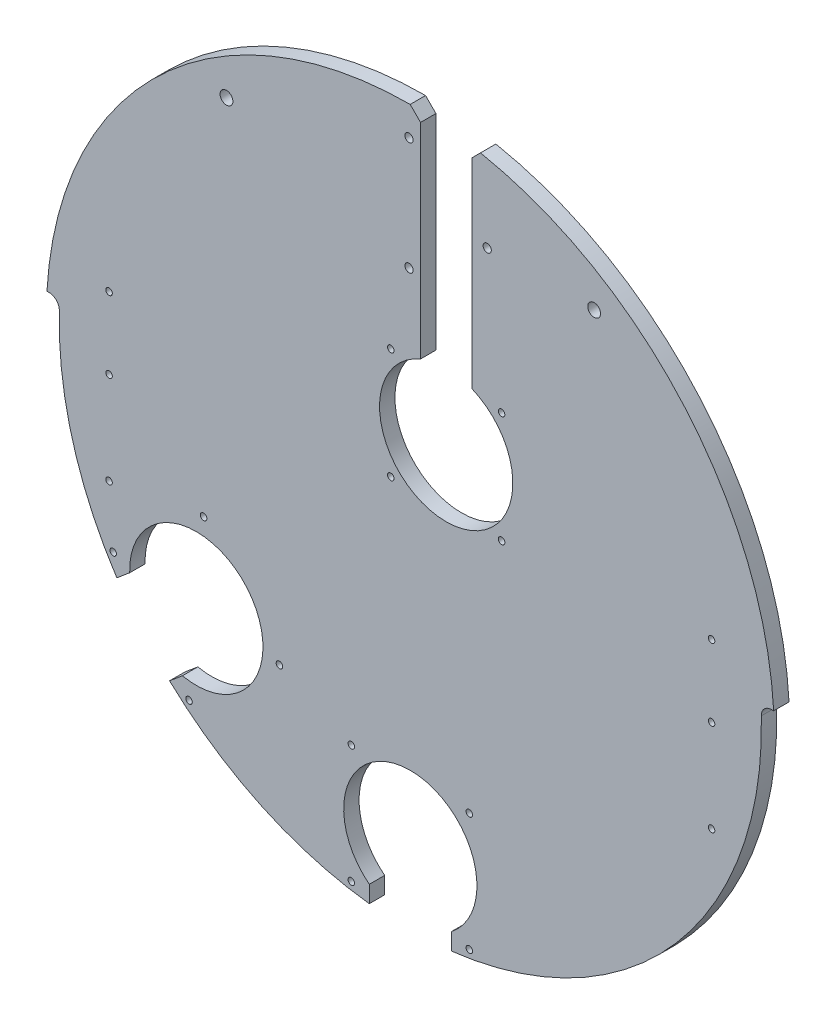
SolidWorks part; units mm, degrees
ref_plane "Front Plane" through (0, 0, 0) normal (0, 0, 1) x (1, 0, 0)
ref_plane "Top Plane" through (0, 0, 0) normal (0, 1, 0) x (1, 0, 0)
ref_plane "Right Plane" through (0, 0, 0) normal (1, 0, 0) x (0, 0, -1)
sketch "Sketch1" plane through (0, 0, 0) normal (0, 0, 1) x (1, 0, 0)
  line L5 (-254, 6.35) -> (254, 6.35) construction
  line L6 (0, 0) -> (0, 6.35) construction
  circle A0 centre (0, 0) radius 217.4875
  dimension "D1" = 434.975
extrude "Boss-Extrude1" add sketch "Sketch1" along normal mid plane 9.525
hole_wizard "#10-32 Tapped Hole1" positions "Sketch3" profile "Sketch2" tap size "#10-32" standard "ANSI Inch"
sketch "Sketch3" plane through (0, 0, 4.7625) normal (0, 0, 1) x (1, 0, 0)
  line L0 (0, 0) -> (0, -270.3197) construction
  circle A0 centre (-186.5948, 31.75) radius 2.8067 construction
  circle A1 centre (-186.5948, -69.85) radius 2.8067 construction
  circle A2 centre (-186.5948, -12.7) radius 2.8067 construction
  point P0 (-186.5948, -69.85)
  point P9 (-186.5948, 31.75)
  point P13 (186.5948, -69.85)
  point P14 (186.5948, 31.75)
  point P21 (-186.5948, -12.7)
  point P27 (186.5948, -12.7)
sketch "Sketch2" plane through (-186.5948, -69.85, 4.7625) normal (1, 0, 0) x (0, -1, 0)
  line L0 (0, 0) -> (0, 10.7383)
  line L1 (0, 10.7383) -> (2.0193, 9.525)
  line L2 (2.0193, 9.525) -> (2.0193, 0)
  line L5 (2.0193, 0) -> (0, 0)
  line L10 (0, 10.7383) -> (-2.0193, 9.525) construction
  line L11 (0, -6.35) -> (0, 107.95) construction
  dimension "Tap Drill Dia." = 4.0386
  dimension "Tap Drill Depth" = 9.525
  dimension "Drill Angle" = 118
sketch "Sketch4" plane through (0, 0, 4.7625) normal (0, 0, 1) x (1, 0, 0)
  line L0 (-132.5544, -111.2264) -> (132.5544, -111.2264) construction
  line L1 (0, 0) -> (0, -111.2264) construction
  line L2 (0, 0) -> (-132.5544, -111.2264) construction
  line L3 (-63.5, 98.425) -> (63.5, 98.425) construction
  line L4 (-63.5, 98.425) -> (-63.5, 15.875) construction
  line L5 (-63.5, 15.875) -> (63.5, 15.875) construction
  line L6 (63.5, 98.425) -> (63.5, 15.875) construction
  line L7 (-63.5, 98.425) -> (63.5, 15.875) construction
  line L8 (-63.5, 15.875) -> (63.5, 98.425) construction
  line L9 (0, 0) -> (0, -173.0375) construction
  line L10 (0, 0) -> (-44.858, 37.3498) construction
  line L11 (22.225, 53.975) -> (-22.225, 53.975) construction
  line L12 (22.225, 53.975) -> (0, 0) construction
  line L13 (-132.5544, -111.2264) -> (0, -173.0375) construction
  line L14 (0, 53.975) -> (0, 0) construction
  circle A0 centre (-132.5544, -111.2264) radius 41.275
  circle A1 centre (132.5544, -111.2264) radius 41.275 construction
  circle A2 centre (0, -173.0375) radius 41.275
  circle A3 centre (0, 57.15) radius 41.275 construction
  arc A4 (4.1485, 85.725) -> (4.1485, 22.225) centre (-22.225, 53.975) ccw construction
  circle A5 centre (-132.5544, -111.2264) radius 44.45 construction
  circle A6 centre (22.225, 53.975) radius 41.275
  circle A7 centre (0, 0) radius 217.4875 construction
  dimension "D1" = 82.55
  dimension "D2" = 173.0375
  dimension "D5" = 57.15
  dimension "D8" = 44.45
  dimension "D3" = 50
  dimension "D4" = 22.225
  dimension "D6" = 127
  dimension "D7" = 53.975
extrude "Cut-Extrude1" cut sketch "Sketch4" against normal through all
fillet "Fillet1" [suppressed] radius 9.525
sketch "Sketch6" plane through (0, 0, 4.7625) normal (0, 0, 1) x (1, 0, 0)
  line L0 (-225.067, 12.7) -> (-217.1164, 12.7)
  line L1 (217.1164, 12.7) -> (225.067, 12.7)
  arc A0 (225.067, 12.7) -> (-225.067, 12.7) centre (0, 0) ccw
  arc A1 (217.1164, 12.7) -> (-217.1164, 12.7) centre (0, 0) ccw
  circle A2 centre (0, 0) radius 217.4875 construction
  dimension "D1" = 7.9375
  dimension "D2" = 12.7
extrude "Boss-Extrude2" add sketch "Sketch6" against normal up to surface (9.525 mm away)
fillet "Fillet2" radius 6.35 2 edges at (217.1164, 12.7, 0) (-217.1164, 12.7, 0)
sketch "Sketch7" [suppressed] plane through (0, 0, 4.7625) normal (0, 0, 1) x (1, 0, 0)
  line L0 (-128.2637, 123.825) -> (128.2637, 123.825)
  line L1 (41.275, 98.425) -> (-41.275, 98.425) construction
  arc A0 (-136.9596, 145.7809) -> (136.9596, 145.7809) centre (0, 0) cw
  arc A1 (225.067, 12.7) -> (-225.067, 12.7) centre (0, 0) ccw construction
  arc A2 (136.9596, 145.7809) -> (128.2637, 123.825) centre (128.2637, 136.525) cw
  arc A3 (-128.2637, 123.825) -> (-136.9596, 145.7809) centre (-128.2637, 136.525) cw
  dimension "D1" = 25.4
  dimension "D3" = 12.7
  dimension "D2" = 25.4
hole_wizard "3/8-16 Tapped Hole1" positions "Sketch9" profile "Sketch8" tap size "3/8-16" standard "ANSI Inch"
sketch "Sketch9" plane through (0, 0, 4.7625) normal (0, 0, 1) x (1, 0, 0)
  line L2 (-113.8692, 172.1175) -> (113.8692, 172.1175) construction
  line L4 (0, 0) -> (0, 172.1175) construction
  circle A0 centre (0, 0) radius 206.375 construction
  point P0 (113.8692, 172.1175)
  point P6 (-113.8692, 172.1175)
  dimension "D1" = 412.75
  dimension "D2" = 227.7385
sketch "Sketch8" plane through (113.8692, 172.1175, 4.7625) normal (1, 0, 0) x (0, -1, 0)
  line L0 (0, 0) -> (0, 34.1347)
  line L1 (0, 34.1347) -> (3.9687, 31.75)
  line L2 (3.9687, 31.75) -> (3.9687, 0)
  line L5 (3.9687, 0) -> (0, 0)
  line L10 (0, 34.1347) -> (-3.9688, 31.75) construction
  line L11 (0, -6.35) -> (0, 107.95) construction
  dimension "Tap Drill Dia." = 7.9375
  dimension "Tap Drill Depth" = 31.75
  dimension "Drill Angle" = 118
hole_wizard "#10-32 Tapped Hole2" positions "Sketch11" profile "Sketch10" tap size "#10-32" standard "ANSI Inch"
sketch "Sketch11" [suppressed] plane through (0, 0, 4.7625) normal (0, 0, 1) x (1, 0, 0)
  line L0 (107.95, -50.8) -> (107.95, -6.35) construction
  point P0 (107.95, -6.35)
  dimension "D1" = 44.45
sketch "Sketch10" plane through (107.95, -6.35, 4.7625) normal (1, 0, 0) x (0, -1, 0)
  line L0 (0, 0) -> (0, 9.525)
  line L1 (0, 9.525) -> (2.0193, 9.525)
  line L2 (2.0193, 9.525) -> (2.0193, 0)
  line L5 (2.0193, 0) -> (0, 0)
  line L11 (0, -6.35) -> (0, 107.95) construction
  dimension "Thru Tap Drill Dia." = 4.0386
  dimension "Thru Tap Drill Depth" = 9.525
sketch "Sketch16" plane through (0, 0, 4.7625) normal (0, 0, 1) x (1, 0, 0)
  line L0 (-110.4833, -161.8054) -> (-153.4213, -253.8862) construction
  line L1 (-153.4213, -253.8862) -> (-95.8708, -280.7225) construction
  line L2 (-95.8708, -280.7225) -> (-52.9328, -188.6416) construction
  line L3 (15.4308, -139.9459) -> (-117.1236, -78.1348) construction
  line L4 (-132.5544, -111.2264) -> (0, -173.0375) construction
  line L5 (-147.9853, -144.3179) -> (-110.4833, -161.8054) construction
  line L6 (-15.4308, -206.1291) -> (-52.9328, -188.6416) construction
  line L7 (15.4308, -139.9459) -> (-15.4308, -206.1291) construction
  line L8 (-66.2772, -142.1319) -> (-50.8464, -109.0404) construction
  line L9 (-117.1236, -78.1348) -> (-147.9853, -144.3179) construction
  line L10 (0, 0) -> (-124.6461, -267.3044) construction
  line L11 (22.225, 53.975) -> (22.225, 225.425) construction
  line L12 (6.35, 53.975) -> (38.1, 53.975)
  line L15 (38.1, 53.975) -> (38.1, 225.425)
  line L16 (38.1, 225.425) -> (6.35, 225.425)
  line L17 (6.35, 225.425) -> (6.35, 53.975)
  arc A0 (225.067, 12.7) -> (-225.067, 12.7) centre (0, 0) ccw construction
  circle A1 centre (22.225, 53.975) radius 41.275 construction
  circle A2 centre (22.225, 53.975) radius 36.5125 construction
  circle A3 centre (-132.5544, -111.2264) radius 36.5125 construction
  circle A4 centre (0, -173.0375) radius 36.5125 construction
  circle A5 centre (22.225, 53.975) radius 41.275 construction
  point P11 (-66.2772, -142.1319)
  dimension "D3" = 73.025
  dimension "D4" = 57.15
  dimension "D1" = 63.5
  dimension "D2" = 101.6
  dimension "D5" = 31.75
extrude "Cut-Extrude3" cut sketch "Sketch16" against normal through all
sketch "Sketch21" [suppressed] plane through (0, 0, 4.7625) normal (0, 0, 1) x (1, 0, 0)
  line L0 (44.45, 88.7554) -> (44.45, 220.9992) construction
  line L1 (-6.35, 168.275) -> (0, 168.275)
  line L2 (-6.35, 168.275) -> (-6.35, 127)
  line L3 (-6.35, 127) -> (0, 127)
  line L4 (0, 168.275) -> (0, 127)
  line L5 (44.45, 168.275) -> (50.8, 168.275)
  line L6 (44.45, 168.275) -> (44.45, 127)
  line L7 (44.45, 127) -> (50.8, 127)
  line L8 (50.8, 168.275) -> (50.8, 127)
  line L9 (0, 225.425) -> (0, 88.7554) construction
  line L10 (-14.2875, 92.075) -> (-7.9375, 92.075) construction
  dimension "D1" = 6.35
  dimension "D2" = 34.925
  dimension "D3" = 41.275
hole_wizard "#10-32 Tapped Hole3" positions "Sketch13" profile "Sketch12" tap size "#10-32" standard "ANSI Inch"
sketch "Sketch13" plane through (0, 0, 4.7625) normal (0, 0, 1) x (1, 0, 0)
  line L0 (36.5496, -209.5871) -> (0, -173.0375) construction
  line L4 (0, 0) -> (0, -173.0375) construction
  line L5 (0, -173.0375) -> (0, -112.7063) construction
  line L6 (36.5496, -136.4879) -> (0, -173.0375) construction
  line L7 (0, -173.0375) -> (-36.5496, -136.4879) construction
  line L8 (-36.5496, -136.4879) -> (-36.5496, -209.5871) construction
  line L9 (-36.5496, -209.5871) -> (0, -173.0375) construction
  point P0 (36.5496, -209.5871)
  point P12 (-36.5496, -209.5871)
  point P18 (-36.5496, -136.4879)
  point P20 (36.5496, -136.4879)
  dimension "D1" = 51.689
  dimension "D2" = 135
sketch "Sketch12" plane through (36.5496, -209.5871, 4.7625) normal (1, 0, 0) x (0, -1, 0)
  line L0 (0, 0) -> (0, 9.525)
  line L1 (0, 9.525) -> (2.0193, 9.525)
  line L2 (2.0193, 9.525) -> (2.0193, 0)
  line L5 (2.0193, 0) -> (0, 0)
  line L11 (0, -6.35) -> (0, 107.95) construction
  dimension "Thru Tap Drill Dia." = 4.0386
  dimension "Thru Tap Drill Depth" = 9.525
hole_wizard "#10-32 Tapped Hole4" positions "Sketch15" profile "Sketch14" tap size "#10-32" standard "ANSI Inch"
sketch "Sketch15" plane through (0, 0, 4.7625) normal (0, 0, 1) x (1, 0, 0)
  line L0 (-184.0467, -106.7214) -> (-132.5544, -111.2264) construction
  line L3 (22.225, 53.975) -> (56.5296, 19.6704) construction
  line L4 (0, 0) -> (-132.5544, -111.2264) construction
  line L5 (-132.5544, -111.2264) -> (-70.9428, -59.528) construction
  line L6 (-137.0594, -162.7187) -> (-132.5544, -111.2264) construction
  line L8 (-128.0494, -59.7341) -> (-132.5544, -111.2264) construction
  line L9 (-132.5544, -111.2264) -> (-81.0621, -115.7314) construction
  line L10 (-12.0796, 19.6704) -> (22.225, 53.975) construction
  line L11 (22.225, 53.975) -> (56.5296, 88.2796) construction
  line L12 (-12.0796, 88.2796) -> (22.225, 53.975) construction
  line L14 (22.225, 53.975) -> (22.225, 86.6259) construction
  arc A0 (6.35, 92.075) -> (38.1, 92.075) centre (22.225, 53.975) ccw construction
  point P0 (-184.0467, -106.7214)
  point P9 (56.5296, 19.6704)
  point P23 (-137.0594, -162.7187)
  point P33 (-128.0494, -59.7341)
  point P35 (-81.0621, -115.7314)
  point P46 (-12.0796, 19.6704)
  point P48 (56.5296, 88.2796)
  point P57 (-12.0796, 88.2796)
  dimension "D1" = 51.689
  dimension "D2" = 135
  dimension "D3" = 48.514
  dimension "D4" = 90
  dimension "D5" = 45
sketch "Sketch14" plane through (-184.0467, -106.7214, 4.7625) normal (1, 0, 0) x (0, -1, 0)
  line L0 (0, 0) -> (0, 9.525)
  line L1 (0, 9.525) -> (2.0193, 9.525)
  line L2 (2.0193, 9.525) -> (2.0193, 0)
  line L5 (2.0193, 0) -> (0, 0)
  line L11 (0, -6.35) -> (0, 107.95) construction
  dimension "Thru Tap Drill Dia." = 4.0386
  dimension "Thru Tap Drill Depth" = 9.525
fillet "Fillet4" [suppressed] radius 3.175
sketch "Sketch17" [suppressed] plane through (0, 0, 4.7625) normal (0, 0, 1) x (1, 0, 0)
  line L0 (-141.9048, -139.2158) -> (-15.4308, -198.1916)
  line L1 (-15.4308, -198.1916) -> (-17.4436, -202.5079)
  line L2 (-17.4436, -202.5079) -> (-143.9175, -143.5321)
  line L3 (-143.9175, -143.5321) -> (-141.9048, -139.2158)
  line L4 (-124.4607, -147.3501) -> (-107.4431, -155.2856) construction
  circle A0 centre (-126.4739, -106.1242) radius 41.275 construction
  circle A1 centre (-126.4739, -106.1242) radius 41.275 construction
  circle A2 centre (0, -165.1) radius 41.275 construction
extrude "Cut-Extrude4" [suppressed] cut sketch "Sketch17" against normal through all
sketch "Sketch22" plane through (0, 0, 4.7625) normal (0, 0, 1) x (1, 0, 0)
  line L0 (-25.4, -205.2892) -> (-25.4, -217.4875)
  line L1 (-25.4, -217.4875) -> (25.4, -217.4875)
  line L2 (25.4, -217.4875) -> (25.4, -205.2892)
  line L4 (0, 0) -> (0, -173.0375) construction
  arc A0 (-217.4, 6.1699) -> (217.4, 6.1699) centre (0, 0) ccw construction
  arc A1 (25.4, -205.2892) -> (-25.4, -205.2892) centre (0, -184.9438) ccw
  dimension "D2" = 65.0875
  dimension "D1" = 50.8
extrude "Cut-Extrude7" cut sketch "Sketch22" against normal blind 152.4
hole_wizard "Hole1" positions "Sketch19" profile "Sketch18" legacy
sketch "Sketch19" [suppressed] plane through (0, 0, 4.7625) normal (0, 0, 1) x (1, 0, 0)
  line L0 (0, 0) -> (-95.5319, -149.955) construction
  line L2 (-44.8357, -135.379) -> (-69.525, -174.1333) construction
  line L3 (-138.3762, -122.6602) -> (-95.5319, -149.955) construction
  point P0 (-138.3762, -122.6602)
  dimension "D1" = 177.8
  dimension "D2" = 50.8
sketch "Sketch18" plane through (-138.3762, -122.6602, 4.7625) normal (1, 0, 0) x (0, -1, 0)
  line L0 (0, 0) -> (0, 9.525)
  line L1 (0, 9.525) -> (3.175, 9.525)
  line L2 (3.175, 9.525) -> (3.175, 0)
  line L3 (3.175, 0) -> (0, 0)
  line L4 (0, 110) -> (0, -10) construction
  dimension "Diameter" = 6.35
  dimension "Depth" = 9.525
chamfer "Chamfer3" [suppressed] distance 3.175 angle 45
chamfer "Chamfer4" distance 6.35 angle 45 2 edges at (38.1, 222.182, 0) (6.35, 225.3355, 0)
sketch "Sketch20" [suppressed] plane through (0, 0, 4.7625) normal (0, 0, 1) x (1, 0, 0)
  line L1 (-4.7625, 155.575) -> (46.8313, 155.575)
  line L2 (-7.9375, 152.4) -> (-7.9375, 120.65)
  line L3 (-4.7625, 117.475) -> (46.8313, 117.475)
  line L4 (50.0063, 152.4) -> (50.0063, 120.65)
  line L7 (44.45, 88.7554) -> (44.45, 210.2141) construction
  line L8 (-7.9375, 92.075) -> (-7.9375, 82.1503) construction
  arc A0 (0, 88.7554) -> (44.45, 88.7554) centre (22.225, 53.975) ccw construction
  arc A1 (46.8313, 155.575) -> (50.0063, 152.4) centre (46.8313, 152.4) cw
  arc A2 (50.0063, 120.65) -> (46.8313, 117.475) centre (46.8313, 120.65) cw
  arc A3 (-4.7625, 117.475) -> (-7.9375, 120.65) centre (-4.7625, 120.65) cw
  arc A4 (-7.9375, 152.4) -> (-4.7625, 155.575) centre (-4.7625, 152.4) cw
  dimension "D5" = 3.175
  dimension "D1" = 5.5563
  dimension "D3" = 38.1
  dimension "D4" = 63.5
extrude "Cut-Extrude5" [suppressed] cut sketch "Sketch20" against normal through all
chamfer "Chamfer5" [suppressed] distance 3.175 angle 45
extrude "Cut-Extrude6" [suppressed] cut sketch "Sketch21" against normal through all
fillet "Fillet6" [suppressed] radius 3.175
pattern_circular "CirPattern1" count 2 every 50 about axis through (0, 0, 4.7625) along (0, 0, -1) of "Cut-Extrude7"
hole_wizard "1/4-20 Tapped Hole1" positions "Sketch24" profile "Sketch23" tap size "1/4-20" standard "ANSI Inch"
sketch "Sketch24" plane through (0, 0, 4.7625) normal (0, 0, 1) x (1, 0, 0)
  line L0 (-0.7938, 207.1687) -> (-0.7938, 137.3187) construction
  line L2 (6.35, 218.9855) -> (6.35, 92.075) construction
  line L3 (-0.7938, 172.2437) -> (47.625, 172.2437) construction
  line L5 (38.1, 92.075) -> (38.1, 215.832) construction
  arc A1 (6.35, 92.075) -> (38.1, 92.075) centre (22.225, 53.975) ccw construction
  point P0 (-0.7938, 207.1687)
  point P2 (-0.7938, 137.3187)
  point P16 (47.625, 172.2437)
  dimension "D3" = 83.3438
  dimension "D1" = 7.1437
  dimension "D2" = 69.85
  dimension "D4" = 9.525
sketch "Sketch23" plane through (-0.7938, 207.1687, 4.7625) normal (1, 0, 0) x (0, -1, 0)
  line L0 (0, 0) -> (0, 9.525)
  line L1 (0, 9.525) -> (2.5527, 9.525)
  line L2 (2.5527, 9.525) -> (2.5527, 0)
  line L5 (2.5527, 0) -> (0, 0)
  line L11 (0, -6.35) -> (0, 107.95) construction
  dimension "Thru Tap Drill Dia." = 5.1054
  dimension "Thru Tap Drill Depth" = 9.525
